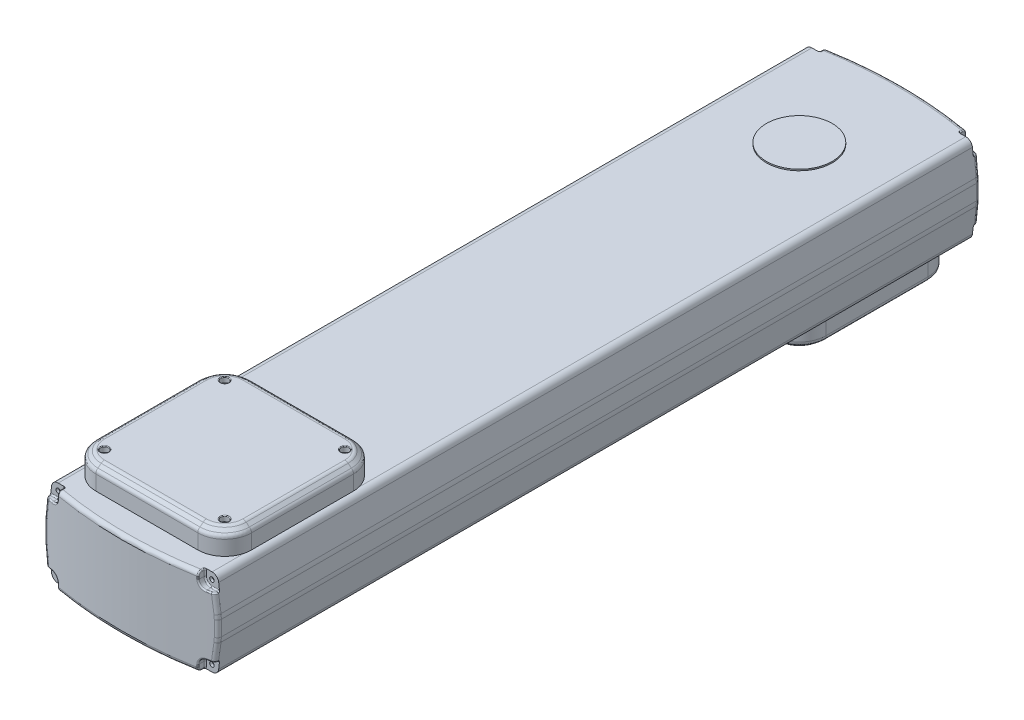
SolidWorks part; units mm, degrees
ref_plane "前视基准面" through (0, 0, 0) normal (0, 0, 1) x (1, 0, 0)
ref_plane "上视基准面" through (0, 0, 0) normal (0, 1, 0) x (1, 0, 0)
ref_plane "右视基准面" through (0, 0, 0) normal (1, 0, 0) x (0, 0, -1)
imported_body "输入1"
other "移动面1" parameters "D1"=55
